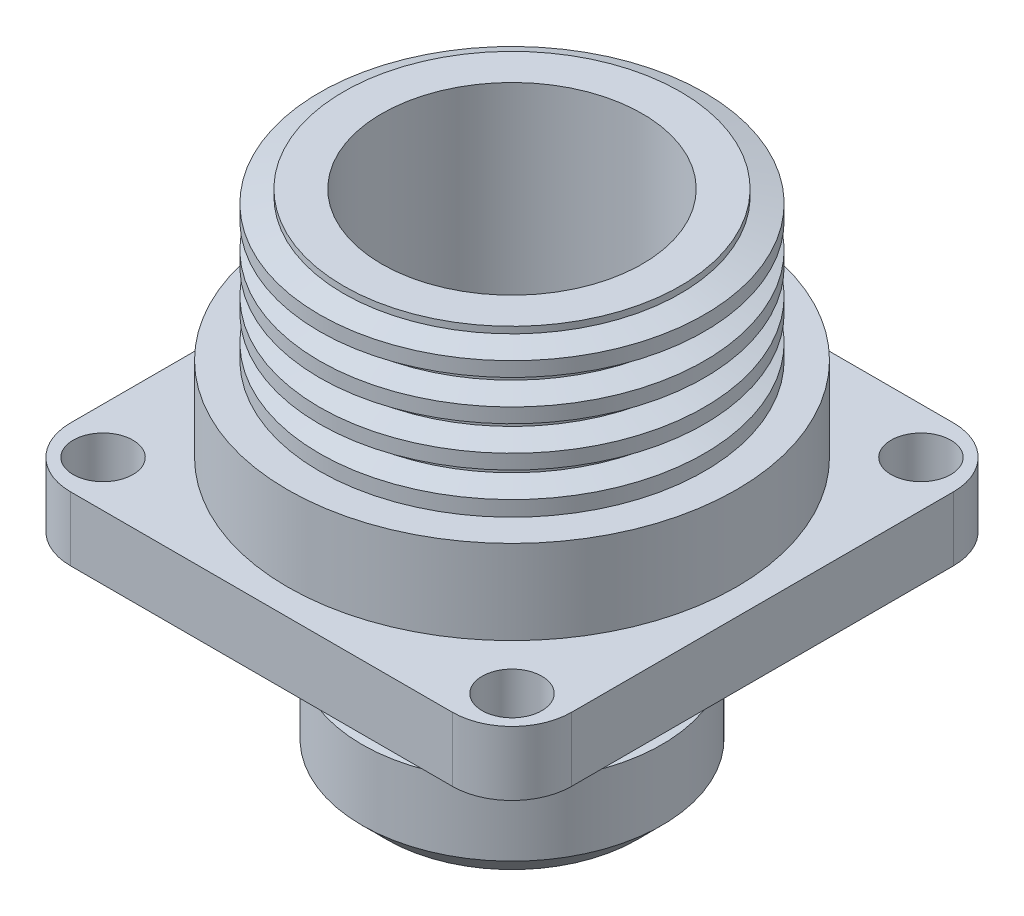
SolidWorks part; units mm, degrees
ref_plane "Front" through (0, 0, 0) normal (0, 0, 1) x (1, 0, 0)
ref_plane "Top" through (0, 0, 0) normal (0, 1, 0) x (1, 0, 0)
ref_plane "Right" through (0, 0, 0) normal (1, 0, 0) x (0, 0, -1)
sketch "Sketch1" plane through (0, 0, 0) normal (0, 1, 0) x (1, 0, 0)
  line L0 (-15.875, 15.875) -> (15.875, -15.875) construction
  line L1 (-15.875, 15.875) -> (15.875, 15.875)
  line L2 (-15.875, 15.875) -> (-15.875, -15.875)
  line L3 (-15.875, -15.875) -> (15.875, -15.875)
  line L4 (15.875, 15.875) -> (15.875, -15.875)
  line L5 (0, 0) -> (0, 12.3288) construction
  line L6 (0, 0) -> (-11.4601, 0) construction
  circle A0 centre (-12.954, 12.954) radius 1.8923
  circle A1 centre (12.954, 12.954) radius 1.8923
  circle A2 centre (12.954, -12.954) radius 1.8923
  circle A3 centre (-12.954, -12.954) radius 1.8923
  dimension "D4" = 3.7846
  dimension "D1" = 31.75
  dimension "D2" = 31.75
  dimension "D3" = 12.954
extrude "Base-Extrude" add sketch "Sketch1" along normal blind 4.064
sketch "Sketch2" plane through (0, 4.064, 0) normal (0, 1, 0) x (-1, 0, 0)
  circle A0 centre (0, 0) radius 14.224
  dimension "D1" = 28.448
sketch "Sketch3" plane through (0, 0, 0) normal (0, -1, 0) x (1, 0, 0)
  circle A0 centre (0, 0) radius 9.4996
  dimension "D1" = 18.9992
extrude "Boss-Extrude2" add sketch "Sketch3" along normal blind 12.954
chamfer "Chamfer1" distance 1.5748 angle 45 1 edges at (0, -12.954, -9.4996)
fillet "Fillet1" radius 3.7846 4 edges at (-15.875, 2.032, -15.875) (15.875, 2.032, -15.875) (15.875, 2.032, 15.875) (-15.875, 2.032, 15.875)
ref_plane "Plane1" through (0, -12.954, 0) normal (-1, 0, 0) x (0, 0, 1)
ref_plane "Plane2" through (0, -12.954, 0) normal (-1, 0, 0) x (0, 0, 1)
ref_plane "Plane3" through (0, -12.954, 0) normal (-1, 0, 0) x (0, 0, 1)
sketch "Sketch11" plane through (0, -12.954, 0) normal (-1, 0, 0) x (0, 0, 1)
  line L0 (8.4869, 8.4582) -> (9.6139, 8.5568)
  line L1 (9.6139, 8.5568) -> (9.6139, 5.9974)
  line L2 (9.6139, 5.9974) -> (8.4869, 6.096)
  line L3 (8.255, 6.349) -> (8.255, 8.2052)
  line L4 (0, 50) -> (0, -50) construction
  line L6 (-12.0904, 12.954) -> (12.0904, 12.954) construction
  arc A0 (8.4869, 6.096) -> (8.255, 6.349) centre (8.509, 6.349) cw
  arc A1 (8.255, 8.2052) -> (8.4869, 8.4582) centre (8.509, 8.2052) cw
  dimension "D1" = 6.858
revolve "Groove for AS 568-016, O-Ring1" cut sketch "Sketch11"
extrude "Extrude1" add sketch "Sketch2" along normal blind 5.334
sketch "Sketch12" plane through (0, 9.398, 0) normal (0, 1, 0) x (-1, 0, 0)
  circle A0 centre (0, 0) radius 12.192
  dimension "D1" = 24.384
extrude "Extrude2" add sketch "Sketch12" along normal blind 9.398
sketch "Sketch13" plane through (0, 0, 0) normal (0, 0, 1) x (1, 0, 0)
  line L0 (0, 0) -> (0, 18.796) construction
  line L1 (12.192, 18.796) -> (-12.192, 18.796) construction
  line L3 (12.192, 9.398) -> (12.192, 18.796) construction
  line L4 (10.668, 19.211) -> (10.668, 18.381)
  line L5 (10.668, 18.381) -> (12.192, 17.9869)
  line L6 (10.668, 19.211) -> (12.192, 19.6051)
  line L7 (10.668, 16.671) -> (10.668, 15.841)
  line L8 (10.668, 15.841) -> (12.192, 15.4469)
  line L9 (10.668, 16.671) -> (12.192, 17.0651)
  line L10 (10.668, 14.131) -> (10.668, 13.301)
  line L11 (10.668, 13.301) -> (12.192, 12.9069)
  line L12 (10.668, 14.131) -> (12.192, 14.5251)
  line L13 (10.668, 11.591) -> (10.668, 10.761)
  line L14 (10.668, 10.761) -> (12.192, 10.3669)
  line L15 (10.668, 11.591) -> (12.192, 11.9851)
  line L16 (12.192, 10.3669) -> (13.8779, 10.3669)
  line L17 (12.192, 19.6051) -> (13.8779, 19.6051)
  line L18 (13.8779, 10.3669) -> (13.8779, 19.6051)
  line L19 (12.192, 17.9869) -> (12.192, 17.0651)
  line L20 (12.192, 15.4469) -> (12.192, 14.5251)
  line L21 (12.192, 12.9069) -> (12.192, 11.9851)
  point P13 (10.668, 18.796)
  point P18 (10.668, 16.256)
  point P23 (10.668, 13.716)
  point P28 (10.668, 11.176)
  dimension "D1" = 29
  dimension "D2" = 1.524
revolve "Cut-Revolve5" cut sketch "Sketch13" angle 360 about L0
sketch "Sketch14" plane through (0, 18.796, 0) normal (0, 1, 0) x (-1, 0, 0)
  circle A0 centre (0, 0) radius 8.255
  dimension "D1" = 16.51
extrude "Cut-Extrude1" cut sketch "Sketch14" against normal blind 14.478
sketch "Sketch15" plane through (0, -12.954, 0) normal (0, -1, 0) x (1, 0, 0)
  circle A0 centre (0, 0) radius 6.502
extrude "Cut-Extrude2" cut sketch "Sketch15" against normal blind 7.62
sketch "Sketch16" plane through (0, 0, 0) normal (1, 0, 0) x (0, 0, -1)
  line L1 (12.0904, 0) -> (15.875, 0) construction
  line L2 (13.1835, 0) -> (13.0505, 0)
  line L3 (10.2887, 1.3208) -> (12.6983, 1.3208)
  line L4 (13.1835, 0) -> (13.1835, -0.5778)
  line L6 (0, 0) -> (0, -13.9133) construction
  line L7 (12.8248, 1.2053) -> (12.924, 0.1155)
  line L8 (10.1622, 1.2053) -> (10.063, 0.1155)
  line L9 (13.1835, -0.5778) -> (9.8308, -0.5778)
  line L10 (9.8308, 0) -> (9.8308, -0.5778)
  line L11 (9.9365, 0) -> (9.8308, 0)
  arc A0 (12.6983, 1.3208) -> (12.8248, 1.2053) centre (12.6983, 1.1938) cw
  arc A1 (10.1622, 1.2053) -> (10.2887, 1.3208) centre (10.2887, 1.1938) cw
  arc A2 (12.924, 0.1155) -> (13.0505, 0) centre (13.0505, 0.127) ccw
  arc A3 (10.063, 0.1155) -> (9.9365, 0) centre (9.9365, 0.127) cw
  point P15 (12.8143, 1.3208)
  point P18 (10.1727, 1.3208)
  dimension "D3" = 0.127
  dimension "D1" = 0.127
  dimension "D2" = 2.6416
revolve "Cut-Revolve6" cut sketch "Sketch16" angle 360 about L6
